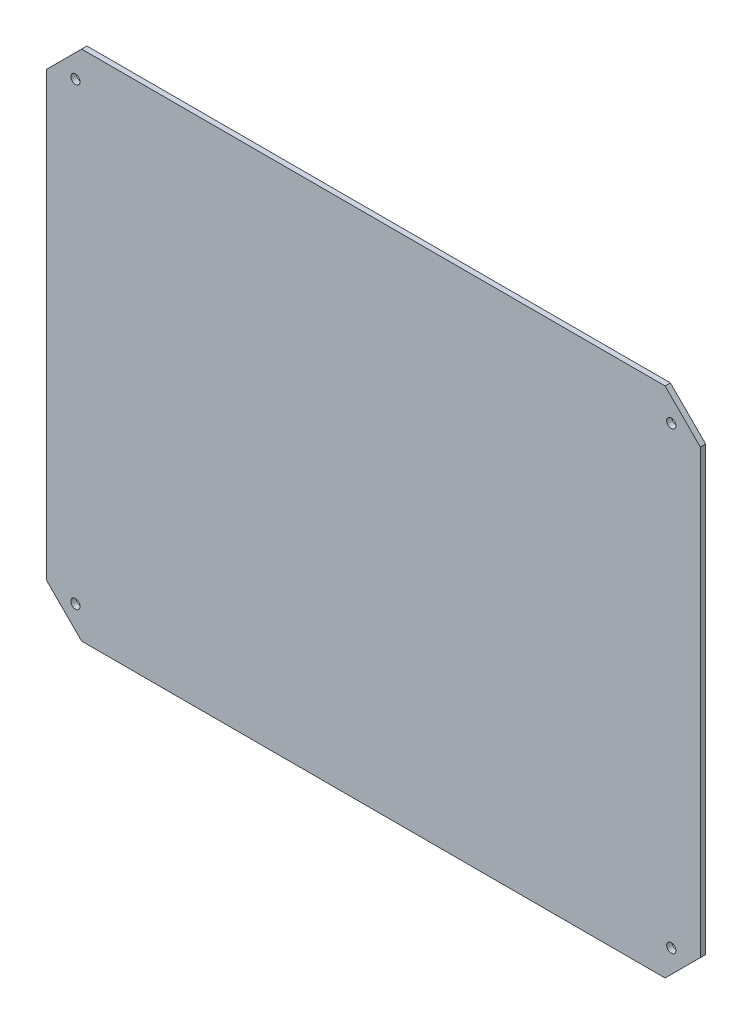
SolidWorks part; units mm, degrees
ref_plane "Front Plane" through (0, 0, 0) normal (0, 0, 1) x (1, 0, 0)
ref_plane "Top Plane" through (0, 0, 0) normal (0, 1, 0) x (1, 0, 0)
ref_plane "Right Plane" through (0, 0, 0) normal (1, 0, 0) x (0, 0, -1)
sketch "Sketch1" plane through (0, 0, 0) normal (0, 0, 1) x (1, 0, 0)
  line L0 (0, 0) -> (370, 0)
  line L1 (370, 0) -> (370, 290)
  line L2 (370, 290) -> (0, 290)
  line L3 (0, 290) -> (0, 0)
extrude "Boss-Extrude1" add sketch "Sketch1" along normal blind 3
chamfer "Chamfer1" distance 20 angle 45 4 edges at (0, 290, 1.5) (0, 0, 1.5) (370, 0, 1.5) (370, 290, 1.5)
sketch "Sketch2" plane through (0, 0, 3) normal (0, 0, 1) x (1, 0, 0)
  line L0 (10, 10) -> (16.4983, 16.4983) construction
  line L2 (0, 20) -> (20, 0) construction
  line L4 (360, 10) -> (353.5017, 16.4983) construction
  line L8 (360, 280) -> (353.5017, 273.5017) construction
  line L10 (10, 280) -> (16.4983, 273.5017) construction
  line L12 (20, 290) -> (0, 270) construction
  line L13 (370, 270) -> (350, 290) construction
  line L14 (350, 0) -> (370, 20) construction
  circle A7 centre (16.4983, 16.4983) radius 2.6
  circle A8 centre (353.5017, 16.4983) radius 2.6
  circle A9 centre (353.5017, 273.5017) radius 2.6
  circle A10 centre (16.4983, 273.5017) radius 2.6
extrude "Cut-Extrude1" cut sketch "Sketch2" against normal through all
